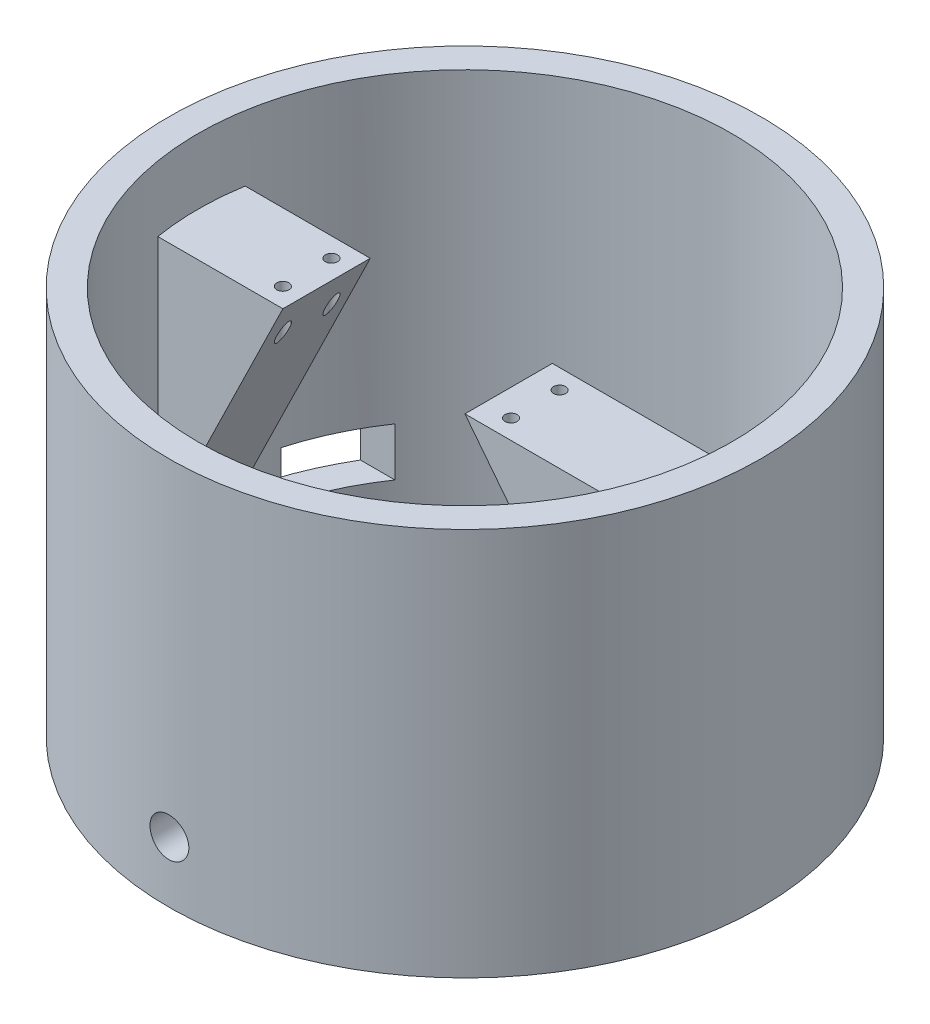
SolidWorks part; units mm, degrees
ref_plane "Front Plane" through (0, 0, 0) normal (0, 0, 1) x (1, 0, 0)
ref_plane "Top Plane" through (0, 0, 0) normal (0, 1, 0) x (1, 0, 0)
ref_plane "Right Plane" through (0, 0, 0) normal (1, 0, 0) x (0, 0, -1)
sketch "Sketch1" plane through (0, 0, 0) normal (0, 1, 0) x (1, 0, 0)
  circle A0 centre (0, 0) radius 55
  dimension "D1" = 110
extrude "Extrude-Thin1" add sketch "Sketch1" along normal blind 80 thin
hole_wizard "M3 Tapped Hole1" positions "Sketch2" profile "Sketch3" tap size "M3" standard "ISO"
sketch "Sketch2" plane through (0, 0, 0) normal (0, -1, 0) x (-1, 0, 0)
  line L0 (0, -61) -> (0, -55) construction
  line L2 (0, 55) -> (0, 61) construction
  circle A0 centre (0, 0) radius 61 construction
  circle A1 centre (0, 0) radius 55 construction
  point P0 (0, -58)
  point P17 (-58, 0)
  point P18 (0, 58)
  point P19 (58, 0)
  dimension "D1" = 4
sketch "Sketch3" plane through (0, 0, 58) normal (1, 0, 0) x (0, 0, -1)
  line L0 (0, 0) -> (0, 8.2511)
  line L1 (0, 8.2511) -> (1.25, 7.5)
  line L2 (1.25, 7.5) -> (1.25, 0)
  line L5 (1.25, 0) -> (0, 0)
  line L10 (0, 8.2511) -> (-1.25, 7.5) construction
  line L11 (0, -6.35) -> (0, 107.95) construction
  dimension "Tap Drill Dia." = 2.5
  dimension "Tap Drill Depth" = 7.5
  dimension "Drill Angle" = 118
sketch "Sketch4" plane through (0, 0, 0) normal (0, 0, 1) x (1, 0, 0)
  line L0 (-61, 0) -> (-28.5, 66.5)
  line L1 (-61, 80) -> (-61, 0) construction
  line L2 (-28.5, 66.5) -> (-61, 66.5)
  line L3 (-61, 66.5) -> (-61, 0)
  line L4 (55, 80) -> (-55, 80) construction
  line L5 (61, 0) -> (9, 66.5)
  line L6 (9, 66.5) -> (61, 66.5)
  line L7 (61, 0) -> (61, 80) construction
  line L8 (61, 66.5) -> (61, 0)
  dimension "D1" = 13.5
  dimension "D2" = 32.5
  dimension "D3" = 52
extrude "Boss-Extrude1" add sketch "Sketch4" along normal mid plane 18
sketch "Sketch5" plane through (0, 66.5, 0) normal (0, 1, 0) x (1, 0, 0)
  line L0 (-60.3324, -9) -> (-61, -9) construction
  line L1 (-61, -9) -> (-61, 0) construction
  line L2 (-60.3324, 9) -> (-61, 9) construction
  line L3 (-61, 0) -> (-61, 9) construction
  line L4 (-60.3324, -9) -> (-61, -9)
  line L5 (-61, -9) -> (-61, 0)
  line L6 (-60.3324, 9) -> (-61, 9)
  line L7 (-61, 0) -> (-61, 9)
  line L8 (61, -9) -> (60.3324, -9) construction
  line L9 (61, -9) -> (61, 0) construction
  line L10 (61, 9) -> (60.3324, 9) construction
  line L11 (61, 0) -> (61, 9) construction
  line L12 (61, -9) -> (60.3324, -9)
  line L13 (61, -9) -> (61, 0)
  line L14 (61, 9) -> (60.3324, 9)
  line L15 (61, 0) -> (61, 9)
  arc A0 (-61, 0) -> (-60.3324, -9) centre (0, 0) ccw construction
  arc A1 (-60.3324, 9) -> (-61, 0) centre (0, 0) ccw construction
  arc A2 (-61, 0) -> (-60.3324, -9) centre (0, 0) ccw
  arc A3 (-60.3324, 9) -> (-61, 0) centre (0, 0) ccw
  arc A4 (60.3324, -9) -> (61, 0) centre (0, 0) ccw construction
  arc A5 (61, 0) -> (60.3324, 9) centre (0, 0) ccw construction
  arc A6 (60.3324, -9) -> (61, 0) centre (0, 0) ccw
  arc A7 (61, 0) -> (60.3324, 9) centre (0, 0) ccw
extrude "Cut-Extrude1" cut sketch "Sketch5" against normal through all contours A6 L12 L13 | A2 L4 L5 | A7 L14 L15
sketch "Sketch6" plane through (0, 66.5, 0) normal (0, 1, 0) x (1, 0, 0)
  line L0 (-28.5, -9) -> (-28.5, 9) construction
  line L2 (9, -9) -> (9, 9) construction
  point P1 (-32.5, 5)
  point P3 (-32.5, -5)
  point P4 (14.5, -5)
  point P7 (-28.5, 0)
  point P8 (14.5, 5)
  point P13 (9, 0)
  dimension "D1" = 32.5
  dimension "D2" = 10
  dimension "D3" = 5
  dimension "D4" = 10
  dimension "D5" = 14.5
  dimension "D6" = 5
sketch "Sketch9" plane through (0, 0, 0) normal (-1, 0, 0) x (0, 0, 1)
  line L1 (-31, 7.5) -> (-15, 7.5)
  line L2 (-31, 7.5) -> (-31, 17.5)
  line L3 (-31, 17.5) -> (-15, 17.5)
  line L4 (-15, 7.5) -> (-15, 17.5)
  line L5 (-31, 7.5) -> (-15, 17.5) construction
  line L6 (-31, 17.5) -> (-15, 7.5) construction
  line L7 (0, 0) -> (0, 80) construction
  line L8 (61, 80) -> (-61, 80) construction
  line L9 (-61, 0) -> (61, 0) construction
  point P0 (-23, 12.5)
  dimension "D1" = 16
  dimension "D2" = 10
  dimension "D3" = 7.5
  dimension "D5" = 15
extrude "Cut-Extrude2" cut sketch "Sketch9" along normal blind 100
ref_plane "Plane1" through (9, 0, 0) normal (1, 0, 0) x (0, 0, -1)
sketch "Sketch10" plane through (9, 0, 0) normal (0, 0, -1) x (-1, 0, 0)
  circle A0 centre (9, 12.5) radius 4
  dimension "D1" = 8
  dimension "D2" = 12.5
extrude "Cut-Extrude3" cut sketch "Sketch10" against normal blind 70
hole_wizard "M3 Tapped Hole2" positions "Sketch12" profile "Sketch13" tap size "M3" standard "ISO"
sketch "Sketch12" plane through (0, 66.5, 0) normal (0, 1, 0) x (1, 0, 0)
  point P0 (-32.5, 5)
  point P3 (-32.5, -5)
  point P6 (14.5, -5)
  point P9 (14.5, 5)
sketch "Sketch13" plane through (-32.5, 66.5, -5) normal (1, 0, 0) x (0, 0, 1)
  line L0 (0, 0) -> (0, 66.5)
  line L1 (0, 66.5) -> (1.25, 66.5)
  line L2 (1.25, 66.5) -> (1.25, 0)
  line L5 (1.25, 0) -> (0, 0)
  line L11 (0, -6.35) -> (0, 107.95) construction
  dimension "Thru Tap Drill Dia." = 2.5
  dimension "Thru Tap Drill Depth" = 66.5
